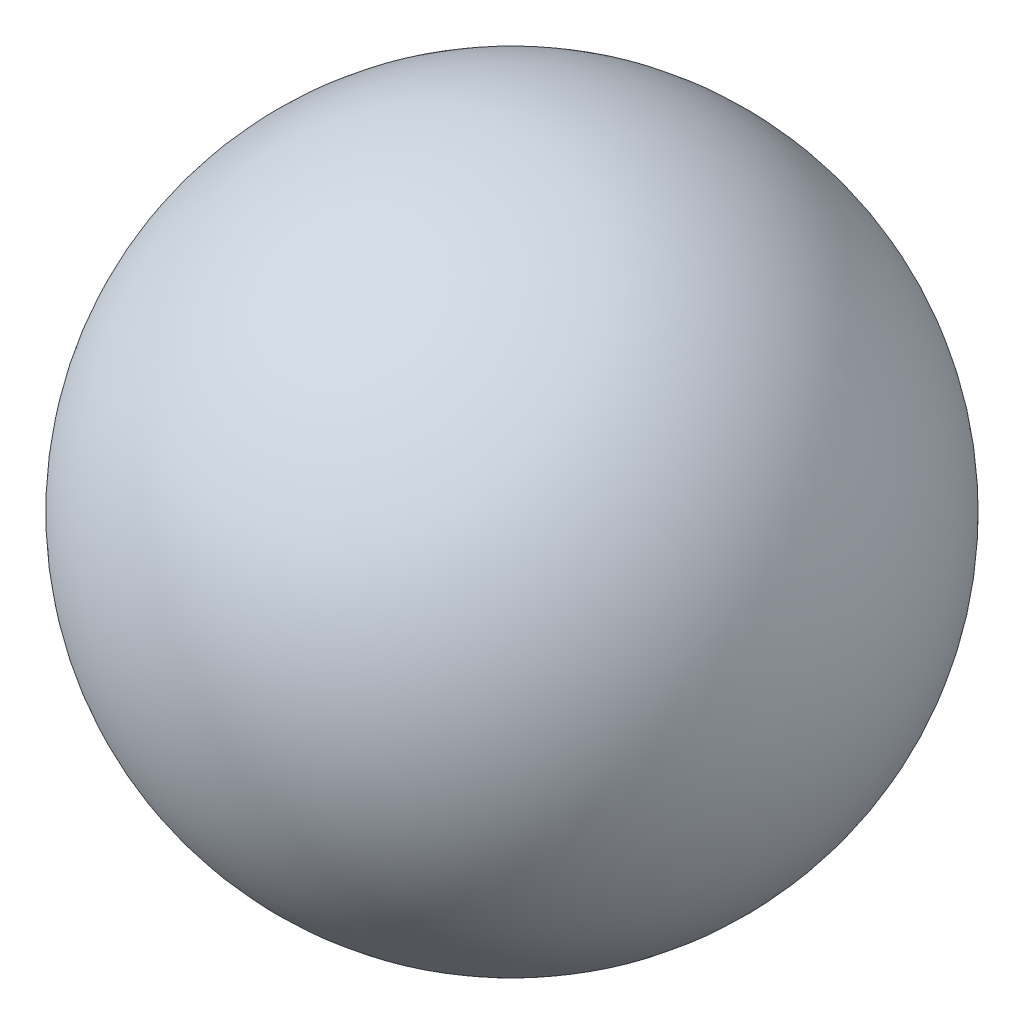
SolidWorks part; units mm, degrees
ref_plane "Front" through (0, 0, 0) normal (0, 0, 1) x (1, 0, 0)
ref_plane "Top" through (0, 0, 0) normal (0, 1, 0) x (1, 0, 0)
ref_plane "Right" through (0, 0, 0) normal (1, 0, 0) x (0, 0, -1)
sketch "Sketch1" plane through (0, 0, 0) normal (1, 0, 0) x (0, 0, -1)
  line L0 (0, 7.9362) -> (0, -7.9362) construction
  line L1 (0, 3.175) -> (0, -3.175)
  arc A0 (0, -3.175) -> (0, 3.175) centre (0, 0) ccw
  dimension "D1" = 6.35
revolve "Revolve1" add sketch "Sketch1" angle 360 about L0
